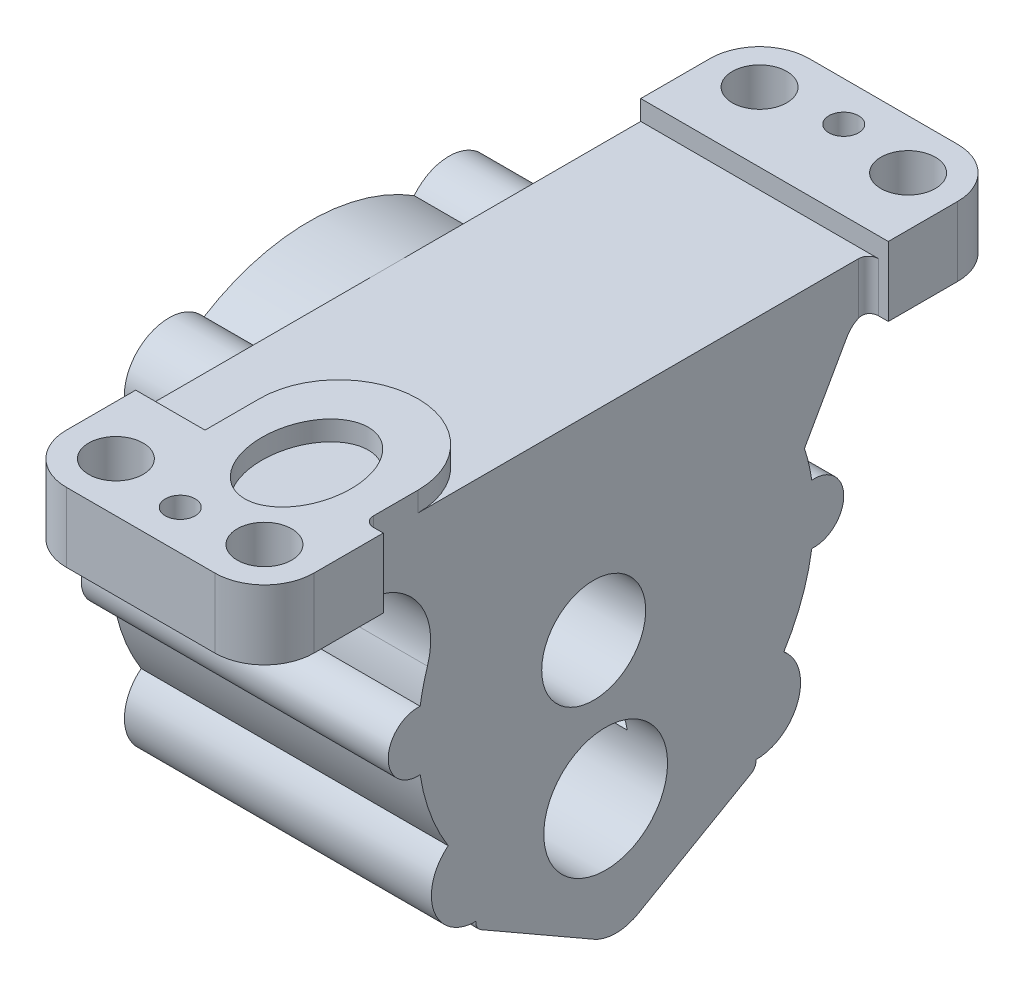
SolidWorks part; units mm, degrees
ref_plane "前视基准面" through (0, 0, 0) normal (0, 0, 1) x (1, 0, 0)
ref_plane "上视基准面" through (0, 0, 0) normal (0, 1, 0) x (1, 0, 0)
ref_plane "右视基准面" through (0, 0, 0) normal (1, 0, 0) x (0, 0, -1)
sketch "草图1" plane through (0, 0, 0) normal (1, 0, 0) x (0, 0, -1)
  line L0 (-77.0759, 0) -> (79.8859, 0) construction
  line L1 (0, 100.3592) -> (0, -109.5922) construction
  line L2 (-75, 40) -> (75, 40)
  line L3 (75, 40) -> (75, 30)
  line L4 (75, 30) -> (51, 30)
  line L5 (46.6448, 27.4561) -> (38.0749, 12.2597)
  line L6 (-75, 40) -> (-75, 30)
  line L7 (-75, 30) -> (-51, 30)
  line L9 (0, 0) -> (-59.8141, -59.8141) construction
  line L10 (-27.2793, -39.2359) -> (-4.5, -52.3011)
  line L11 (27.2793, -39.2359) -> (4.5, -52.3011)
  arc A0 (39.55, 5.9831) -> (38.0749, 12.2597) centre (0, 0) ccw
  arc A1 (-28.2725, -37.2843) -> (-27.2793, -39.2359) centre (-26.2843, -37.501) ccw
  arc A2 (-51, 30) -> (-38.0749, 12.2597) centre (-51, 16.4214) cw
  arc A3 (-4.5, -52.3011) -> (4.5, -52.3011) centre (0, -44.4553) ccw
  arc A4 (28.2725, -37.2843) -> (33.8919, -21.2448) centre (28.2843, -28.2843) ccw
  arc A5 (39.55, -5.9831) -> (39.55, 5.9831) centre (40, 0) ccw
  arc A6 (-39.55, -5.9831) -> (-39.55, 5.9831) centre (-40, 0) cw
  arc A7 (-28.2725, -37.2843) -> (-33.8919, -21.2448) centre (-28.2843, -28.2843) cw
  arc A10 (28.2725, -37.2843) -> (27.2793, -39.2359) centre (26.2843, -37.501) cw
  arc A11 (51, 30) -> (46.6448, 27.4561) centre (51, 25) ccw
  arc A12 (-39.55, -5.9831) -> (-33.8919, -21.2448) centre (0, 0) ccw
  arc A13 (-38.0749, 12.2597) -> (-39.55, 5.9831) centre (0, 0) ccw
  arc A14 (33.8919, -21.2448) -> (39.55, -5.9831) centre (0, 0) ccw
  point P41 (48.0794, 30)
  dimension "D4" = 80
  dimension "D7" = 9.0447
  dimension "D6" = 2
  dimension "D8" = 12
  dimension "D9" = 24
  dimension "D10" = 93.5
  dimension "D12" = 9
  dimension "D14" = 5
  dimension "D1" = 150
  dimension "D2" = 40
  dimension "D3" = 10
  dimension "D5" = 45
  dimension "D11" = 9
  dimension "D13" = 24
  dimension "D15" = 39.55
  dimension "D16" = 26.2843
extrude "拉伸1" add sketch "草图1" against normal blind 46
sketch "草图2" plane through (0, 40, 0) normal (0, 1, 0) x (1, 0, 0)
  line L0 (4, 75) -> (4, 51)
  line L1 (-46, 75) -> (-46, 51)
  line L3 (4, 51) -> (-46, 51)
  line L4 (0, 75) -> (0, -75) construction
  line L5 (-46, 75) -> (4, 75)
  line L10 (-46, 75) -> (0, 75) construction
  dimension "D3" = 4
  dimension "D1" = 50
  dimension "D2" = 24
extrude "拉伸2" add sketch "草图2" along normal blind 4
sketch "草图3" plane through (0, 40, 0) normal (0, 1, 0) x (1, 0, 0)
  line L0 (0, -51) -> (0, -40)
  line L2 (0, 51) -> (0, -75) construction
  line L7 (-46, -75) -> (4, -75)
  line L8 (4, -75) -> (4, -51)
  line L9 (-32, -40) -> (-32, -51)
  line L10 (4, -51) -> (0, -51)
  line L11 (-46, -51) -> (-46, -75)
  line L13 (-46, 75) -> (-46, 51) construction
  line L14 (4, 51) -> (4, 75) construction
  line L15 (-46, -75) -> (0, -75) construction
  line L16 (-32, -51) -> (-46, -51)
  arc A0 (0, -40) -> (-32, -40) centre (-16, -40) ccw
  dimension "D2" = 32
  dimension "D3" = 40
extrude "拉伸3" add sketch "草图3" along normal blind 4
sketch "草图4" plane through (0, 44, 0) normal (0, 1, 0) x (1, 0, 0)
  line L0 (-21, -75) -> (-21, 100.098) construction
  line L1 (-46, 75) -> (-46, 51) construction
  line L2 (4, 51) -> (4, 75) construction
  line L3 (-18.7707, 0) -> (66.1403, 0) construction
  circle A0 centre (-21, -67) radius 3
  circle A1 centre (-21, 67) radius 3
  circle A2 centre (-6, 65) radius 5.5
  circle A3 centre (-36, 65) radius 5.5
  circle A4 centre (-6, -65) radius 5.5
  circle A5 centre (-36, -65) radius 5.5
  dimension "D1" = 6
  dimension "D3" = 11
  dimension "D2" = 134
  dimension "D4" = 30
  dimension "D5" = 130
extrude "切除-拉伸1" cut sketch "草图4" against normal through all
sketch "草图7" plane through (0, 0, 0) normal (-1, 0, 0) x (0, 0, 1)
  line L0 (75, 40) -> (75, 30)
  line L1 (75, 30) -> (51, 30)
  line L2 (51, 30) -> (51, 40)
  line L3 (51, 40) -> (75, 40)
  line L4 (-51, 40) -> (-51, 30)
  line L5 (-51, 30) -> (-75, 30)
  line L6 (-75, 30) -> (-75, 40)
  line L9 (-75, 40) -> (-51, 40)
extrude "拉伸5" add sketch "草图7" against normal up to surface (4 mm away)
fillet "圆角1" radius 10 4 edges at (-46, 37, -75) (-46, 37, 75) (4, 37, -75) (4, 37, 75)
fillet "圆角2" radius 2 2 edges at (0, 37, 51) (0, 35, -51)
sketch "草图9" plane through (-46, 0, 0) normal (1, 0, 0) x (0, 0, -1)
  line L4 (51, 40) -> (-51, 40) construction
  arc A0 (21.2448, 33.8919) -> (33.8919, 21.2448) centre (28.2843, 28.2843) cw
  arc A1 (-39.55, -5.9831) -> (-33.8919, -21.2448) centre (0, 0) ccw
  arc A2 (-33.8919, -21.2448) -> (-28.2725, -37.2843) centre (-28.2843, -28.2843) ccw construction
  arc A3 (-33.8919, -21.2448) -> (-21.2448, -33.8919) centre (-28.2843, -28.2843) ccw
  arc A4 (28.2725, -37.2843) -> (33.8919, -21.2448) centre (28.2843, -28.2843) ccw construction
  arc A5 (-21.2448, 33.8919) -> (-33.8919, 21.2448) centre (-28.2843, 28.2843) ccw
  arc A7 (21.2448, -33.8919) -> (33.8919, -21.2448) centre (28.2843, -28.2843) ccw
  arc A8 (39.55, -5.9831) -> (39.55, 5.9831) centre (40, 0) ccw
  arc A9 (-39.55, 5.9831) -> (-39.55, -5.9831) centre (-40, 0) ccw
  arc A10 (-33.8919, 21.2448) -> (-39.55, 5.9831) centre (0, 0) ccw
  arc A11 (21.2448, 33.8919) -> (-21.2448, 33.8919) centre (0, 0) ccw
  arc A12 (39.55, 5.9831) -> (33.8919, 21.2448) centre (0, 0) ccw
  arc A13 (33.8919, -21.2448) -> (39.55, -5.9831) centre (0, 0) ccw
  arc A14 (-21.2448, -33.8919) -> (21.2448, -33.8919) centre (0, 0) ccw
  circle A15 centre (-40, 0) radius 3
  circle A16 centre (40, 0) radius 3
  circle A17 centre (0, 0) radius 33.5
  arc A18 (39.55, -5.9831) -> (39.55, 5.9831) centre (40, 0) ccw construction
  arc A19 (-39.55, 5.9831) -> (-39.55, -5.9831) centre (-40, 0) ccw construction
  arc A20 (28.2725, -37.2843) -> (33.8919, -21.2448) centre (28.2843, -28.2843) ccw construction
  dimension "D4" = 6
  dimension "D5" = 18.7552
  dimension "D6" = 67
  dimension "D1" = 40
extrude "拉伸6" add sketch "草图9" against normal blind 16
sketch "草图11" plane through (-46, 0, 0) normal (-1, 0, 0) x (0, 0, 1)
  line L3 (27.2793, -39.2359) -> (4.5, -52.3011) construction
  line L4 (-4.5, -52.3011) -> (-27.2793, -39.2359) construction
  line L5 (27.2793, -39.2359) -> (4.5, -52.3011)
  line L6 (-4.5, -52.3011) -> (-27.2793, -39.2359)
  arc A6 (-21.2448, -33.8919) -> (21.2448, -33.8919) centre (0, 0) ccw construction
  arc A7 (21.2448, -33.8919) -> (28.2725, -37.2843) centre (28.2843, -28.2843) ccw construction
  arc A9 (27.2793, -39.2359) -> (28.2725, -37.2843) centre (26.2843, -37.501) ccw construction
  arc A10 (-4.5, -52.3011) -> (4.5, -52.3011) centre (0, -44.4553) ccw construction
  arc A11 (-28.2725, -37.2843) -> (-27.2793, -39.2359) centre (-26.2843, -37.501) ccw construction
  arc A12 (-28.2725, -37.2843) -> (-21.2448, -33.8919) centre (-28.2843, -28.2843) ccw construction
  arc A13 (-21.2448, -33.8919) -> (21.2448, -33.8919) centre (0, 0) ccw
  arc A14 (21.2448, -33.8919) -> (28.2725, -37.2843) centre (28.2843, -28.2843) ccw
  arc A15 (27.2793, -39.2359) -> (28.2725, -37.2843) centre (26.2843, -37.501) ccw
  arc A16 (-4.5, -52.3011) -> (4.5, -52.3011) centre (0, -44.4553) ccw
  arc A17 (-28.2725, -37.2843) -> (-27.2793, -39.2359) centre (-26.2843, -37.501) ccw
  arc A18 (-28.2725, -37.2843) -> (-21.2448, -33.8919) centre (-28.2843, -28.2843) ccw
extrude "切除-拉伸3" cut sketch "草图11" against normal blind 12
sketch "草图12" plane through (-46, 0, 0) normal (-1, 0, 0) x (0, 0, 1)
  circle A0 centre (0, 0) radius 33.5
  circle A1 centre (0, 0) radius 33.5 construction
extrude "切除-拉伸4" cut sketch "草图12" against normal blind 18
sketch "草图13" plane through (-28, 0, 0) normal (-1, 0, 0) x (0, 0, 1)
  line L0 (-27.2213, 10) -> (-5.298, 10)
  line L1 (0, 0) -> (10.5361, 0) construction
  line L2 (-27.2213, -10) -> (-5.298, -10)
  line L3 (28.3725, 6) -> (17.1491, 6)
  line L4 (28.3725, -6) -> (17.1491, -6)
  arc A0 (28.3725, 6) -> (-27.2213, 10) centre (0, 0) ccw
  arc A1 (-27.2213, -10) -> (28.3725, -6) centre (0, 0) ccw
  arc A2 (-5.298, -10) -> (17.1491, -6) centre (4.5, 0) ccw
  arc A3 (17.1491, 6) -> (-5.298, 10) centre (4.5, 0) ccw
  dimension "D1" = 58
  dimension "D3" = 28
  dimension "D2" = 20
  dimension "D4" = 12
extrude "切除-拉伸5" cut sketch "草图13" against normal blind 20
sketch "草图15" plane through (0, 0, 0) normal (1, 0, 0) x (0, 0, -1)
  circle A0 centre (-2.0812, -28.9252) radius 12.5
  arc A1 (-28.3725, -6) -> (27.2213, -10) centre (0, 0) ccw construction
  dimension "D1" = 25
extrude "切除-拉伸7" cut sketch "草图15" against normal blind 26
sketch "草图16" plane through (-28, 0, 0) normal (-1, 0, 0) x (0, 0, 1)
  circle A0 centre (4.5, 0) radius 10.5
  dimension "D1" = 21
  dimension "D2" = 4.5
extrude "切除-拉伸8" cut sketch "草图16" against normal through all
hole_wizard "M10 螺纹孔2" positions "草图21" profile "草图20" tap size "M10" standard "ISO"
sketch "草图21" plane through (-62, 0, 0) normal (-1, 0, 0) x (0, 0, 1)
  point P1 (-28.2843, 28.2843)
  point P4 (28.2843, 28.2843)
  point P7 (28.2843, -28.2843)
  point P10 (-28.2843, -28.2843)
sketch "草图20" plane through (-62, 28.2843, -28.2843) normal (0, 1, 0) x (0, 0, 1)
  line L0 (0, 0) -> (0, 18.5537)
  line L1 (0, 18.5537) -> (4.25, 16)
  line L2 (4.25, 16) -> (4.25, 0)
  line L5 (4.25, 0) -> (0, 0)
  line L10 (0, 18.5537) -> (-4.25, 16) construction
  line L11 (0, -6.35) -> (0, 107.95) construction
  dimension "蹟恇謂郰芛眻噤" = 8.5
  dimension "蹟恇謂郰芛旮僅" = 16
  dimension "絳芛褒僅" = 118
sketch "草图22" plane through (0, 44, 0) normal (0, 1, 0) x (1, 0, 0)
  line L0 (-50.1453, -4.5) -> (4, -4.5) construction
  line L1 (-16, -40) -> (-16, -15.0526) construction
  line L3 (4, -13.5) -> (4, 4.5) construction
  arc A1 (0, -40) -> (-32, -40) centre (-16, -40) ccw construction
  ellipse E0 centre (-16, -46.5) end of major axis (-16, -59) minor radius 9
  dimension "D3" = 10
  dimension "D1" = 42
  dimension "D2" = 18
extrude "切除-拉伸10" cut sketch "草图22" against normal up to surface (4 mm away)
